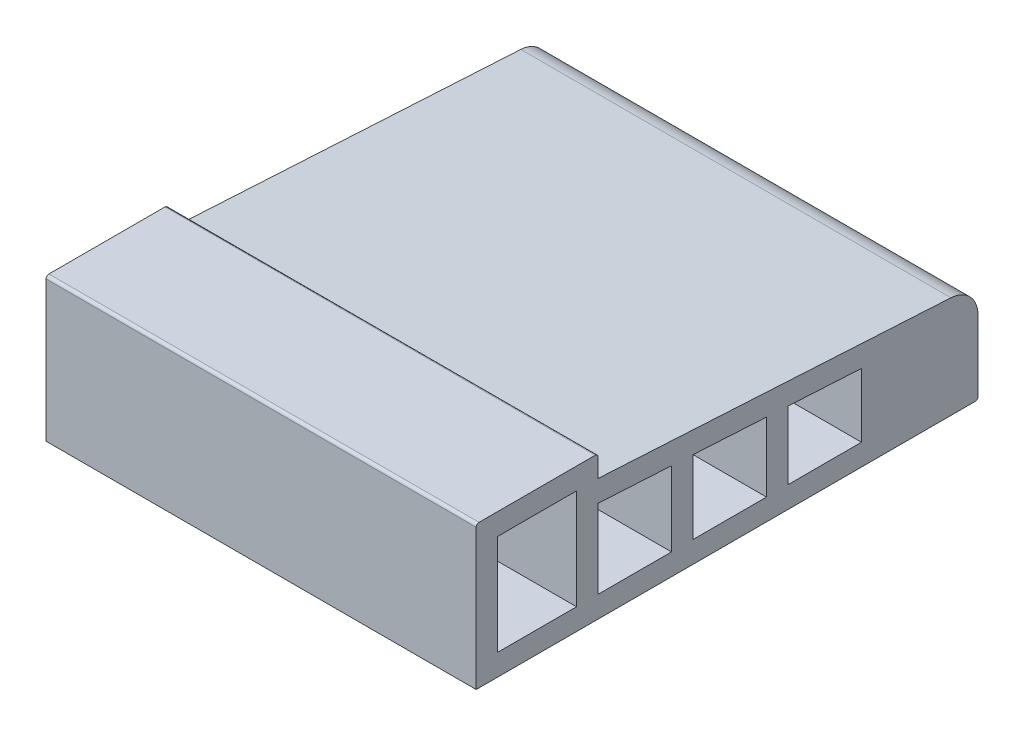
SolidWorks part; units mm, degrees
ref_plane "Face" through (0, 0, 0) normal (0, 0, 1) x (1, 0, 0)
ref_plane "Dessus" through (0, 0, 0) normal (0, 1, 0) x (1, 0, 0)
ref_plane "Droite" through (0, 0, 0) normal (1, 0, 0) x (0, 0, -1)
sketch "Esquisse1" plane through (0, 0, 0) normal (1, 0, 0) x (0, 0, -1)
  line L0 (-6.3934, 0) -> (44.7315, 0) construction
  line L1 (0, -8.3606) -> (0, 26.3259) construction
  line L2 (-6.3934, 10) -> (44.7315, 10) construction
  line L3 (35, -8.3606) -> (35, 26.3259) construction
  line L4 (21, 15.2858) -> (21, -8.3606) construction
  line L5 (1.5, 15.2858) -> (1.5, -8.3606) construction
  line L6 (7, 15.2858) -> (7, -8.3606) construction
  line L7 (8.5, 15.2858) -> (8.5, -8.3606) construction
  line L8 (16.8349, 8.5) -> (-6.3934, 8.5) construction
  line L9 (-6.3934, 1.5) -> (38.6815, 1.5) construction
  line L10 (38.6815, 5.5) -> (6.264, 5.5) construction
  line L11 (38.6815, 7) -> (7.6328, 7) construction
  line L12 (13.625, -8.3606) -> (13.625, 6.1862) construction
  line L13 (33.5, -8.3606) -> (33.5, 15.2858) construction
  line L14 (1.5, 8.5) -> (7, 8.5)
  line L15 (1.5, 8.5) -> (1.5, 1.5)
  line L16 (1.5, 1.5) -> (7, 1.5)
  line L17 (7, 8.5) -> (7, 1.5)
  line L18 (15.125, -8.3606) -> (15.125, 6.1862) construction
  line L19 (8.5, 8.5) -> (33.113, 7.1068)
  line L20 (20.25, -8.3606) -> (20.25, 6.1862) construction
  line L21 (35, 5.11) -> (35, 0.2)
  line L22 (21.75, 1.5) -> (21.75, 6.2476)
  line L23 (8.5, 1.5) -> (13.625, 1.5)
  line L24 (8.5, 1.5) -> (8.5, 6.9976)
  line L25 (0, 0) -> (0, 9.8)
  line L27 (0.2, 10) -> (8.3, 10)
  line L28 (8.5, 8.5) -> (8.5, 9.8)
  line L29 (13.625, 1.5) -> (13.625, 6.7075)
  line L30 (15.125, 1.5) -> (20.25, 1.5)
  line L31 (15.125, 1.5) -> (15.125, 6.6226)
  line L33 (20.25, 1.5) -> (20.25, 6.3325)
  line L34 (34.8, 0) -> (0, 0)
  line L36 (26.875, 1.5) -> (26.875, 5.9575)
  line L37 (26.875, 1.5) -> (21.75, 1.5)
  line L45 (26.875, 5.9575) -> (21.75, 6.2476)
  line L46 (20.25, 6.3325) -> (15.125, 6.6226)
  line L48 (13.625, 6.7075) -> (8.5, 6.9976)
  arc A0 (33.113, 7.1068) -> (35, 5.11) centre (33, 5.11) cw
  arc A1 (0, 9.8) -> (0.2, 10) centre (0.2, 9.8) cw
  arc A2 (8.3, 10) -> (8.5, 9.8) centre (8.3, 9.8) cw
  arc A3 (35, 0.2) -> (34.8, 0) centre (34.8, 0.2) cw
  point P51 (0, 10)
  point P58 (8.5, 10)
  point P63 (35, 0)
  dimension "D13" = 5.125
  dimension "D14" = 5.125
  dimension "D15" = 2
  dimension "D16" = 0.2
  dimension "D17" = 0.2
  dimension "D1" = 35
  dimension "D2" = 10
  dimension "D3" = 12.5
  dimension "D4" = 1.5
  dimension "D5" = 1.5
  dimension "D6" = 1.5
  dimension "D7" = 1.5
  dimension "D8" = 1.5
  dimension "D9" = 4
  dimension "D10" = 1.5
  dimension "D11" = 5.5
  dimension "D12" = 1.5
extrude "Extrusion1" add sketch "Esquisse1" along normal blind 30
draft "Dépouille1" type of draft neutral plane draft angle 1 faces to draft 16 parameters "D1"=1
